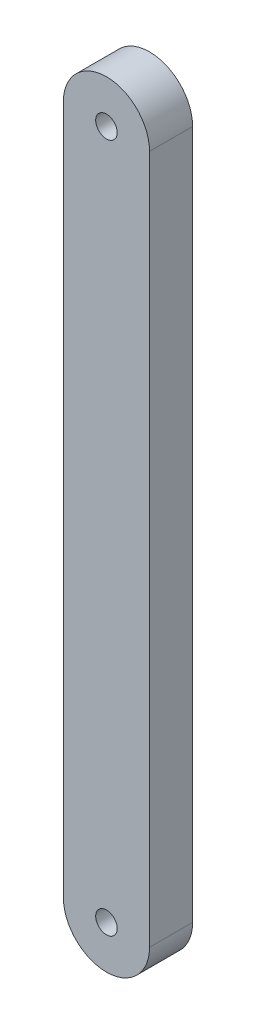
SolidWorks part; units mm, degrees
ref_plane "Ön Düzlem" through (0, 0, 0) normal (0, 0, 1) x (1, 0, 0)
ref_plane "Üst Düzlem" through (0, 0, 0) normal (0, 1, 0) x (1, 0, 0)
ref_plane "Sağ Düzlem" through (0, 0, 0) normal (1, 0, 0) x (0, 0, -1)
sketch "Çizim1" plane through (0, 0, 0) normal (0, 0, 1) x (1, 0, 0)
  line L1 (-20, 125) -> (20, 125)
  line L2 (-20, 125) -> (-20, -125)
  line L4 (20, 125) -> (20, -125)
  line L5 (-20, 125) -> (20, -125) construction
  line L6 (-20, -125) -> (20, 125) construction
  arc A0 (-20, -125) -> (20, -125) centre (0, -125) ccw
  point P0 (0, 0)
  dimension "D1" = 40
  dimension "D2" = 250
extrude "Yükseklik-Ekstrüzyon1" add sketch "Çizim1" along normal blind 20
sketch "Çizim2" plane through (0, 125, 0) normal (0, 1, 0) x (1, 0, 0)
  circle A0 centre (0, -10) radius 50
  dimension "D1" = 100
extrude "Yükseklik-Ekstrüzyon2" add sketch "Çizim2" along normal blind 100
sketch "Çizim3" plane through (0, 0, 20) normal (0, 0, 1) x (1, 0, 0)
  circle A0 centre (0, -125) radius 5
  dimension "D1" = 10
extrude "Kes-Ekstrüzyon1" cut sketch "Çizim3" against normal blind 100
sketch "Çizim4" plane through (0, 225, 0) normal (0, 1, 0) x (1, 0, 0)
  circle A0 centre (0, -10) radius 50
extrude "Kes-Ekstrüzyon2" cut sketch "Çizim4" against normal blind 100
sketch "Çizim5" plane through (0, 125, 0) normal (0, 1, 0) x (1, 0, 0)
  line L0 (-20, -20) -> (-20, 0) construction
  line L1 (-20, 0) -> (20, 0)
  line L2 (-20, 0) -> (-20, -20)
  line L3 (-20, -20) -> (20, -20)
  line L4 (20, 0) -> (20, -20)
  line L5 (-20, 0) -> (20, -20) construction
  line L6 (-20, -20) -> (20, 0) construction
  point P0 (0, -10)
extrude "Yükseklik-Ekstrüzyon3" add sketch "Çizim5" along normal blind 60
sketch "Çizim6" plane through (0, 185, 0) normal (0, 1, 0) x (1, 0, 0)
  circle A0 centre (0, -10) radius 50
  dimension "D1" = 100
extrude "Yükseklik-Ekstrüzyon4" add sketch "Çizim6" along normal blind 100
sketch "Çizim7" plane through (0, 285, 0) normal (0, 1, 0) x (1, 0, 0)
  circle A0 centre (0, -10) radius 50
extrude "Kes-Ekstrüzyon3" cut sketch "Çizim7" against normal blind 100
sketch "Çizim8" plane through (0, 0, 20) normal (0, 0, 1) x (1, 0, 0)
  line L0 (20, 185) -> (20, 195)
  line L1 (-20, 185) -> (-20, 195)
  line L5 (20, -125) -> (20, 185)
  line L6 (20, 185) -> (-20, 185)
  line L7 (-20, 185) -> (-20, -125)
  line L9 (20, 185) -> (-20, 185)
  arc A0 (20, 195) -> (-20, 195) centre (0, 195) ccw
  arc A2 (-20, -125) -> (20, -125) centre (0, -125) ccw
  dimension "D1" = 10
  dimension "D2" = 0
extrude "Yükseklik-Ekstrüzyon5" add sketch "Çizim8" against normal blind 20
sketch "Çizim9" plane through (0, 0, 20) normal (0, 0, 1) x (1, 0, 0)
  circle A0 centre (0, 195) radius 5
  dimension "D1" = 10
extrude "Kes-Ekstrüzyon4" cut sketch "Çizim9" against normal blind 20
